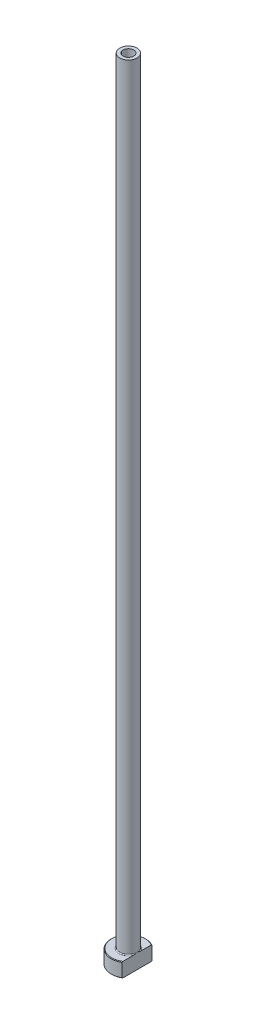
SolidWorks part; units mm, degrees
ref_plane "Front Plane" through (0, 0, 0) normal (0, 0, 1) x (1, 0, 0)
ref_plane "Top Plane" through (0, 0, 0) normal (0, 1, 0) x (1, 0, 0)
ref_plane "Right Plane" through (0, 0, 0) normal (1, 0, 0) x (0, 0, -1)
sketch "Sketch1" plane through (0, 0, 0) normal (0, 0, 1) x (1, 0, 0)
  line L0 (-1.85, 275) -> (-3, 275)
  line L1 (-3, 275) -> (-3, 5)
  line L2 (-3, 5) -> (-6, 5)
  line L3 (-6, 5) -> (-6, 0)
  line L4 (4.95, 0) -> (-4.95, 0) construction
  line L5 (-6, 0) -> (-2.1, 0)
  line L6 (-1.85, 230) -> (-1.85, 275)
  line L7 (0, 92.1877) -> (0, -15.5353) construction
  line L8 (0, -6.6) -> (0, 6.6) construction
  line L9 (-1.85, 230) -> (-2.1, 218)
  line L10 (-2.1, 218) -> (-2.1, 0)
  dimension "D1" = 0.25
  dimension "ID" = 3.7
  dimension "OD" = 6
  dimension "L" = 275
  dimension "H" = 12
  dimension "T" = 5
  dimension "N" = 45
  dimension "D2" = 12
  dimension "L-N" = 230
revolve "Revolve1" add sketch "Sketch1" angle 360 about L7
fillet "Fillet1" radius 0.3 1 edges at (0, 5, 3)
chamfer "Chamfer1" distance 0.2 angle 45 2 edges at (0, 5, 6) (0, 0, 6)
sketch "Sketch2" plane through (0, 0, 0) normal (0, -1, 0) x (1, 0, 0)
  line L0 (3, 5.1962) -> (3, -5.1962)
  circle A0 centre (0, 0) radius 6 construction
  arc A1 (3, 5.1962) -> (3, -5.1962) centre (0, 0) cw
  circle A2 centre (0, 0) radius 3 construction
extrude "Cut-Extrude1" cut sketch "Sketch2" against normal through all
chamfer "Chamfer2" distance 0.5 angle 45 1 edges at (0, 0, 2.1)
